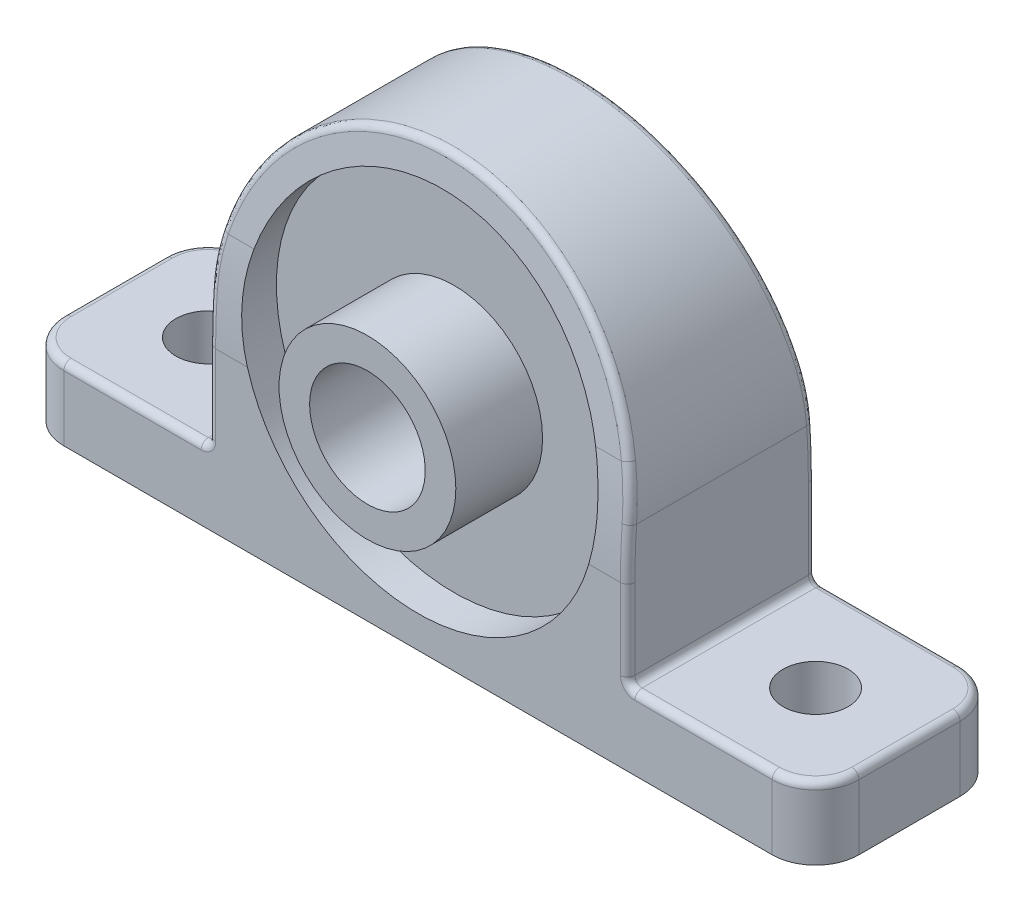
SolidWorks part; units mm, degrees
ref_plane "Plan de face" through (0, 0, 0) normal (0, 0, 1) x (1, 0, 0)
ref_plane "Plan de dessus" through (0, 0, 0) normal (0, 1, 0) x (1, 0, 0)
ref_plane "Plan de droite" through (0, 0, 0) normal (1, 0, 0) x (0, 0, -1)
sketch "Esquisse1" plane through (0, 0, 0) normal (0, 0, 1) x (1, 0, 0)
  line L0 (13, 14.5) -> (13, 5)
  line L1 (55, 29) -> (0, 29) construction
  line L2 (55, 29) -> (55, 0) construction
  line L3 (55, 0) -> (0, 0) construction
  line L4 (0, 29) -> (0, 0) construction
  line L5 (55, 29) -> (0, 0) construction
  line L6 (55, 0) -> (55, 5)
  line L7 (0, 5) -> (55, 5) construction
  line L8 (13, 5) -> (0, 5)
  line L9 (0, 5) -> (0, 0)
  line L10 (55, 0) -> (0, 0)
  line L11 (55, 5) -> (42, 5)
  line L12 (42, 5) -> (42, 14.5)
  circle A0 centre (27.5, 14.5) radius 4
  circle A1 centre (27.5, 14.5) radius 14.5 construction
  arc A2 (13, 14.5) -> (42, 14.5) centre (27.5, 14.5) cw
  point P0 (27.5, 14.5)
  dimension "D4" = 8
  dimension "D1" = 55
  dimension "D2" = 29
  dimension "D5" = 5
extrude "Boss.-Extru.1" add sketch "Esquisse1" along normal blind 13
sketch "Esquisse2" plane through (0, 0, 13) normal (0, 0, 1) x (1, 0, 0)
  circle A0 centre (27.5, 14.5) radius 12.2968
extrude "Enlèv. mat.-Extru.1" cut sketch "Esquisse2" against normal blind 2.5
sketch "Esquisse3" plane through (0, 0, 0) normal (0, 0, -1) x (-1, 0, 0)
  circle A0 centre (-27.5, 14.5) radius 12.2968
  circle A1 centre (-27.5, 14.5) radius 12.2968 construction
extrude "Enlèv. mat.-Extru.2" cut sketch "Esquisse3" against normal blind 2.5
sketch "Esquisse4" plane through (0, 0, 0) normal (0, -1, 0) x (1, 0, 0)
  line L0 (0, 6.5) -> (6.5, 6.5) construction
  line L3 (0, 13) -> (0, 0) construction
  line L4 (6.5, 6.5) -> (48.5, 6.5) construction
  line L5 (48.5, 6.5) -> (55, 6.5) construction
  line L6 (55, 13) -> (55, 0) construction
  circle A0 centre (6.5, 6.5) radius 2.25
  circle A1 centre (48.5, 6.5) radius 2.25
  dimension "D1" = 4.5
  dimension "D2" = 42
extrude "Enlèv. mat.-Extru.3" cut sketch "Esquisse4" against normal through all
sketch "Esquisse5" plane through (0, 0, 0) normal (-1, 0, 0) x (0, 0, 1)
  line L0 (0, 14.5) -> (2, 29)
  line L1 (13, 29) -> (0, 29) construction
  line L2 (2, 29) -> (11, 29)
  line L3 (11, 29) -> (13, 14.5)
  line L4 (13, 14.5) -> (15.7973, 14.5)
  line L5 (15.7973, 14.5) -> (15.7973, 29.9685)
  line L6 (15.7973, 29.9685) -> (-2.6826, 29.9685)
  line L7 (-2.6826, 29.9685) -> (-2.6826, 14.5)
  line L8 (-2.6826, 14.5) -> (0, 14.5)
  line L9 (0, 29) -> (0, 14.5) construction
  dimension "D1" = 2
extrude "Enlèv. mat.-Extru.4" cut sketch "Esquisse5" against normal through all
sketch "Esquisse6" plane through (0, 0, 10.5) normal (0, 0, 1) x (1, 0, 0)
  circle A0 centre (27.5, 14.5) radius 4
  circle A1 centre (27.5, 14.5) radius 6.1146
  circle A2 centre (27.5, 14.5) radius 4 construction
extrude "Boss.-Extru.2" add sketch "Esquisse6" along normal blind 6
sketch "Esquisse7" plane through (0, 0, 2.5) normal (0, 0, -1) x (-1, 0, 0)
  circle A0 centre (-27.5, 14.5) radius 4
  circle A1 centre (-27.5, 14.5) radius 6.1146
  circle A2 centre (-27.5, 14.5) radius 4 construction
  circle A3 centre (-27.5, 14.5) radius 6.1146 construction
extrude "Boss.-Extru.3" add sketch "Esquisse7" along normal blind 0.5
fillet "Congé1" radius 50 4 edges at (40.8984, 14.5, 13) (14.1016, 14.5, 13) (40.8984, 14.5, 0) (14.1016, 14.5, 0)
fillet "Congé2" radius 3 4 edges at (55, 2.5, 0) (55, 2.5, 13) (0, 2.5, 13) (0, 2.5, 0)
fillet "Congé3" radius 0.5 26 edges at (0, 5, 6.5) (55, 5, 6.5) (54.1213, 5, 0.8787) (0.8787, 5, 0.8787) (0.8787, 5, 12.1213) (54.1213, 5, 12.1213) (47, 5, 0) (8, 5, 0) (8, 5, 13) (47, 5, 13) (42, 8.034, 0) (42, 12.785, 0.0295) (13, 8.034, 0) (13, 12.785, 0.0295) (13, 8.034, 13) (13, 12.785, 12.9705) (42, 8.034, 13) (42, 12.785, 12.9705) (13, 5, 6.5) (42, 5, 6.5) (27.5, 29, 2) (27.5, 29, 11)
